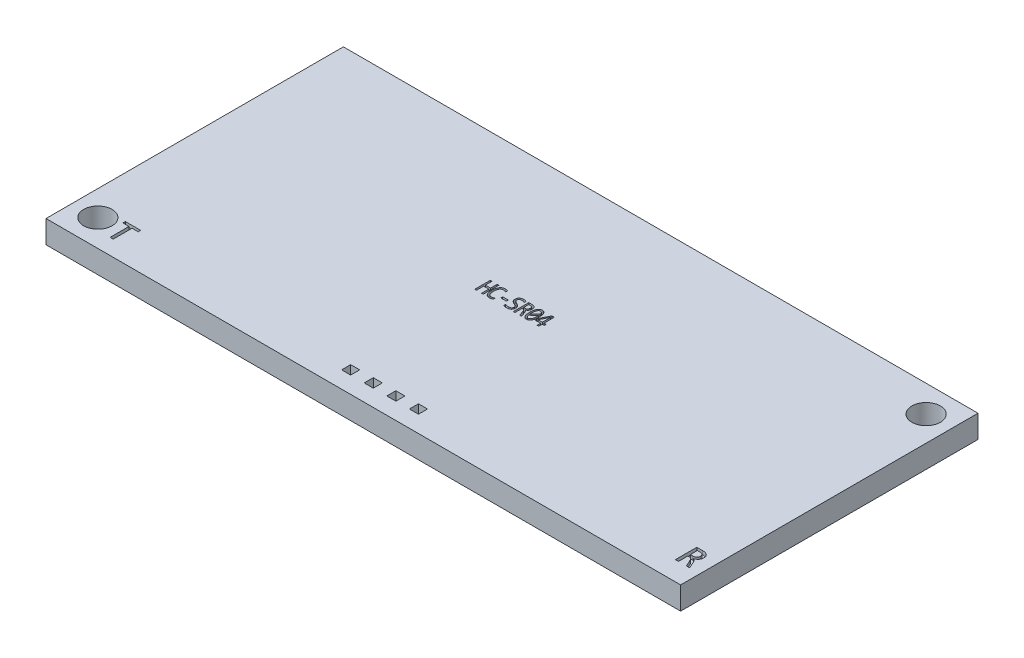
SolidWorks part; units mm, degrees
ref_plane "Alzado" through (0, 0, 0) normal (0, 0, 1) x (1, 0, 0)
ref_plane "Planta" through (0, 0, 0) normal (0, 1, 0) x (1, 0, 0)
ref_plane "Vista lateral" through (0, 0, 0) normal (1, 0, 0) x (0, 0, -1)
sketch "Croquis1" plane through (0, 0, 0) normal (0, 1, 0) x (1, 0, 0)
  line L0 (0, 0) -> (44.6, 0)
  line L1 (44.6, 0) -> (44.6, -20.9)
  line L2 (44.6, -20.9) -> (0, -20.9)
  line L3 (0, -20.9) -> (0, 0)
  line L4 (22.3, 0) -> (22.3, -20.9) construction
  line L5 (0, -10.45) -> (44.6, -10.45) construction
  circle A1 centre (42.8323, -1.8775) radius 1
  circle A3 centre (1.7677, -19.0225) radius 1
extrude "Saliente-Extruir2" add sketch "Croquis1" along normal blind 1.6
ref_plane "Plano1" through (0, 2.3456, 0) normal (0, 1, 0) x (1, 0, 0)
sketch "Croquis3" plane through (0, 2.3456, 0) normal (0, 1, 0) x (1, 0, 0)
  text T0 "HC-SR04" font "Consolas" height 1.0884
extrude "Cortar-Extruir1" cut sketch "Croquis3" against normal blind 1
sketch "Croquis4" plane through (0, 2.3456, 0) normal (0, 1, 0) x (1, 0, 0)
  text T0 "R" font "Consolas" height 1.5
  text T1 "T" font "Consolas" height 1.5
extrude "Cortar-Extruir2" cut sketch "Croquis4" against normal blind 1
sketch "Croquis5" plane through (0, 1.6, 0) normal (0, 1, 0) x (1, 0, 0)
  line L0 (22.3, 0) -> (22.3, -20.9) construction
  line L1 (44.6, 0) -> (0, 0) construction
  line L2 (0, -20.9) -> (44.6, -20.9) construction
  line L3 (22.3, -19.4058) -> (21.8238, -19.4058) construction
  line L4 (21.8238, -19.4058) -> (21.8238, -19.0878) construction
  line L5 (21.8238, -19.4058) -> (21.1878, -19.4058) construction
  line L6 (21.1878, -19.4058) -> (21.1878, -19.7238) construction
  line L7 (21.1878, -19.4058) -> (20.2353, -19.4058) construction
  line L8 (21.8238, -19.0878) -> (21.1878, -19.0878)
  line L9 (21.8238, -19.0878) -> (21.8238, -19.7238)
  line L10 (21.8238, -19.7238) -> (21.1878, -19.7238)
  line L11 (21.1878, -19.0878) -> (21.1878, -19.7238)
  line L12 (22.7763, -19.7238) -> (23.4122, -19.7238)
  line L13 (20.2353, -19.4058) -> (19.5993, -19.4058) construction
  line L14 (24.3647, -19.7238) -> (25.0007, -19.7238)
  line L15 (20.2353, -19.0878) -> (19.5993, -19.0878)
  line L16 (20.2353, -19.0878) -> (20.2353, -19.7238)
  line L17 (22.7763, -19.0878) -> (22.7763, -19.7238)
  line L18 (22.7763, -19.0878) -> (23.4122, -19.0878)
  line L19 (23.4122, -19.0878) -> (23.4122, -19.7238)
  line L20 (20.2353, -19.7238) -> (19.5993, -19.7238)
  line L21 (19.5993, -19.0878) -> (19.5993, -19.7238)
  line L22 (24.3647, -19.0878) -> (24.3647, -19.7238)
  line L23 (24.3647, -19.0878) -> (25.0007, -19.0878)
  line L24 (25.0007, -19.0878) -> (25.0007, -19.7238)
  dimension "D1" = 0.4763
  dimension "D2" = 0.9525
extrude "Cortar-Extruir4" cut sketch "Croquis5" against normal blind 10
